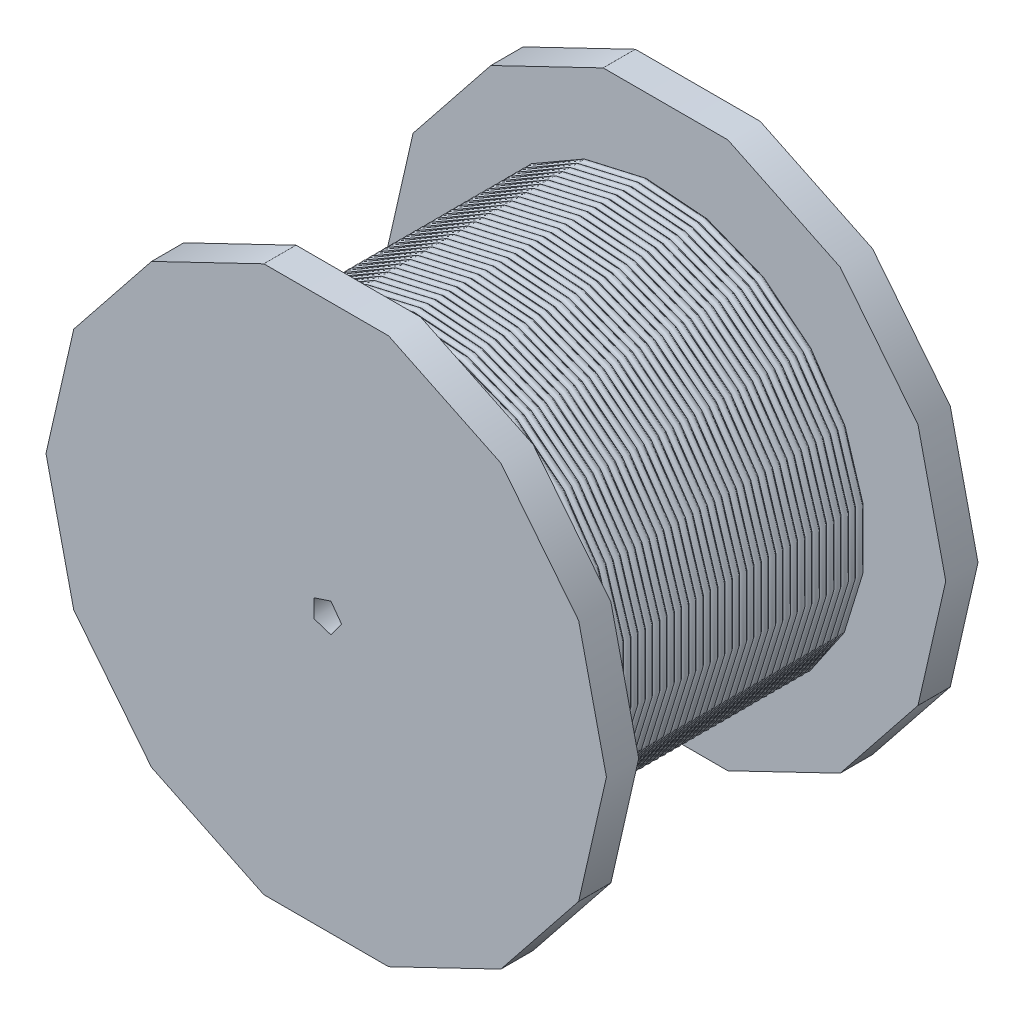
SolidWorks part; units mm, degrees
ref_plane "Plan de face" through (0, 0, 0) normal (0, 0, 1) x (1, 0, 0)
ref_plane "Plan de dessus" through (0, 0, 0) normal (0, 1, 0) x (1, 0, 0)
ref_plane "Plan de droite" through (0, 0, 0) normal (1, 0, 0) x (0, 0, -1)
sketch "Esquisse1" plane through (0, 0, 0) normal (0, 0, 1) x (1, 0, 0)
  circle A0 centre (0, 0) radius 125
  dimension "D1" = 250
extrude "Boss.-Extru.1" add sketch "Esquisse1" along normal blind 200
sketch "Esquisse2" plane through (0, 0, 200) normal (0, 0, 1) x (1, 0, 0)
  circle A0 centre (0, 0) radius 182.5
  dimension "D1" = 365
extrude "Boss.-Extru.2" add sketch "Esquisse2" along normal blind 21
sketch "Esquisse4" plane through (0, 0, 0) normal (0, 0, -1) x (-1, 0, 0)
  circle A0 centre (0, 0) radius 182.5
  dimension "D1" = 365
extrude "Boss.-Extru.3" add sketch "Esquisse4" along normal blind 21
sketch "Esquisse6" plane through (0, 0, 221) normal (0, 0, 1) x (1, 0, 0)
  circle A0 centre (0, 0) radius 10
  dimension "D1" = 20
extrude "Enlèv. mat.-Extru.1" cut sketch "Esquisse6" against normal up to next
ref_plane "Plan1" through (0, 0, 2.36) normal (0, 0, 1) x (1, 0, 0)
sketch "Esquisse10" plane through (0, 0, 0) normal (1, 0, 0) x (0, 0, -1)
  line L0 (84.511, 0) -> (-299.9967, 0) construction
sketch "Esquisse11" plane through (0, 0, 0) normal (1, 0, 0) x (0, 0, -1)
  line L0 (0, 182.5) -> (0, -182.5) construction
  line L1 (-200, -125) -> (0, -125) construction
  circle A0 centre (-2.36, -127.36) radius 2.36
  dimension "D1" = 4.72
  dimension "D2" = 2.36
  dimension "D3" = 2.36
revolve "Révolution1" add sketch "Esquisse11" angle 360 about L0
sketch "Esquisse12" plane through (0, 0, 0) normal (1, 0, 0) x (0, 0, -1)
  line L2 (0, 125) -> (-200, 125) construction
  line L3 (0, 182.5) -> (0, -182.5) construction
  circle A0 centre (-4.72, 131.44) radius 2.36
  dimension "D1" = 6.44
  dimension "D3" = 4.72
  dimension "D2" = 4.72
revolve "Révolution2" add sketch "Esquisse12" angle 360 about L0
pattern_linear "Répétition linéaire6" count 42 spacing 4.72 along (0, 0, 1)
sketch "Esquisse19" plane through (0, 0, 0) normal (1, 0, 0) x (0, 0, -1)
  line L0 (-200, -182.5) -> (-200, 182.5) construction
  circle A0 centre (-195.92, 135.52) radius 2.36
  dimension "D1" = 4.72
  dimension "D2" = 4.08
  dimension "D3" = 135.52
revolve "Révolution3" add sketch "Esquisse19" angle 360 about L0
pattern_linear "Répétition linéaire7" count 5 spacing 4.72 along (0, 0, -1)
